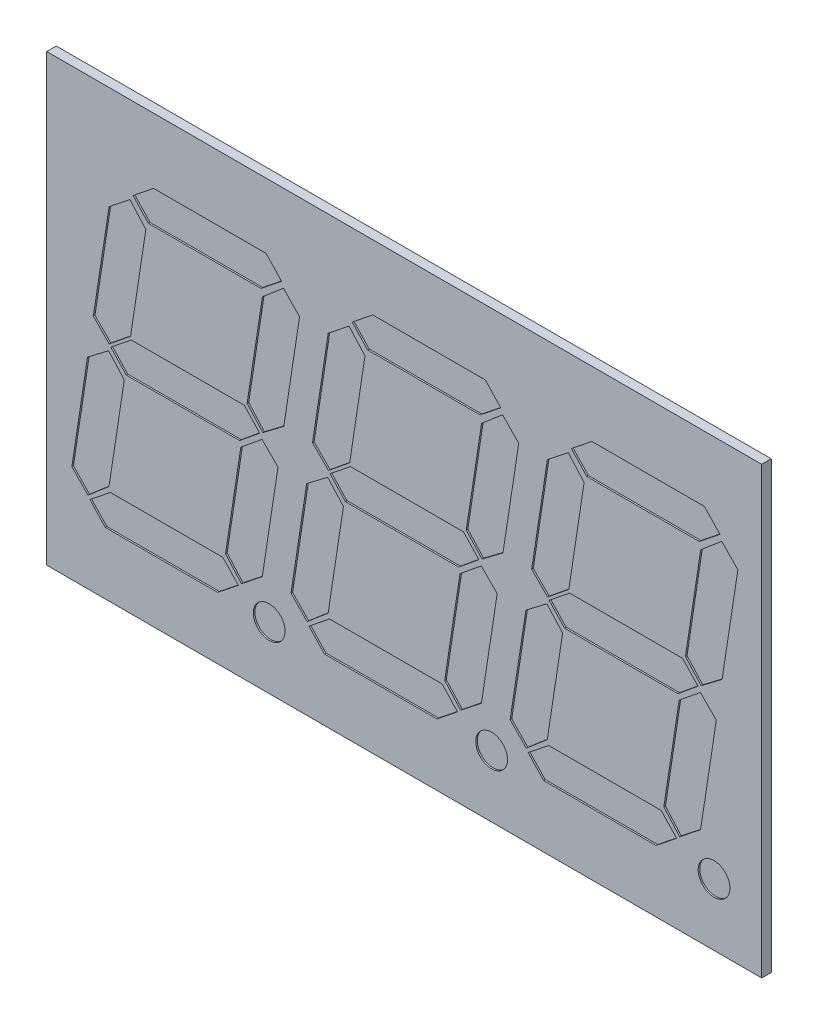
SolidWorks part; units mm, degrees
ref_plane "Front Plane" through (0, 0, 0) normal (0, 0, 1) x (1, 0, 0)
ref_plane "Top Plane" through (0, 0, 0) normal (0, 1, 0) x (1, 0, 0)
ref_plane "Right Plane" through (0, 0, 0) normal (1, 0, 0) x (0, 0, -1)
sketch "Sketch1" plane through (0, 0, 0) normal (0, 0, 1) x (1, 0, 0)
  line L1 (0, 0) -> (-22.5, 0)
  line L2 (0, 0) -> (0, -14)
  line L3 (0, -14) -> (-22.5, -14)
  line L4 (-22.5, 0) -> (-22.5, -14)
  dimension "D1" = 22.5
  dimension "D2" = 14
extrude "Boss-Extrude1" add sketch "Sketch1" along normal mid plane 0.3
sketch "Sketch4" plane through (0, 0, 0) normal (0, 0, 1) x (1, 0, 0)
  line L0 (-22.5, -12.0501) -> (0, -12.0501) construction
  line L1 (-22.5, 0) -> (-22.5, -14) construction
  line L2 (0, -14) -> (0, 0) construction
  line L3 (-22.5, -14) -> (0, -14) construction
  circle A0 centre (-15.5, -12.0501) radius 0.5
  circle A1 centre (-8.5, -12.0501) radius 0.5
  circle A2 centre (-1.5, -12.0501) radius 0.5
  text T0 "888" font "LCDMono" height 10
  point P15 (0, 0)
  point P17 (-4.048, -13.7386)
  dimension "D1" = 1
  dimension "D2" = 7
  dimension "D3" = 1.9499
  dimension "D4" = 7
  dimension "D5" = 7
extrude "Cut-Extrude1" cut sketch "Sketch4" against normal blind 0.05 from surface at 0.15
